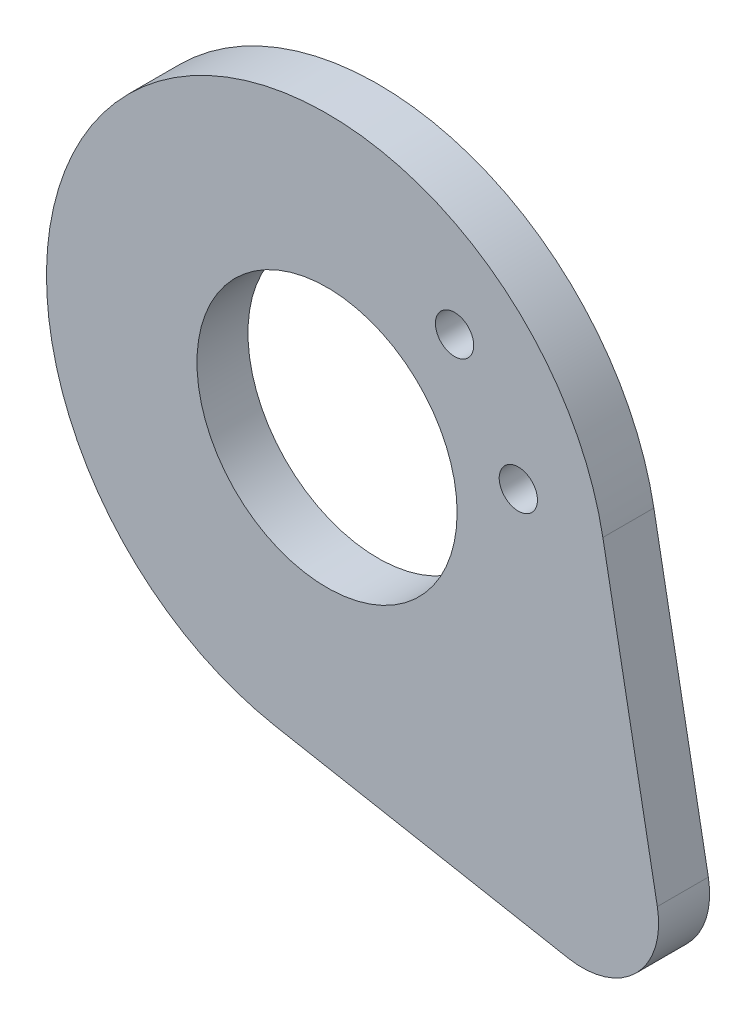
SolidWorks part; units mm, degrees
ref_plane "Alzado" through (0, 0, 0) normal (0, 0, 1) x (1, 0, 0)
ref_plane "Planta" through (0, 0, 0) normal (0, 1, 0) x (1, 0, 0)
ref_plane "Vista lateral" through (0, 0, 0) normal (1, 0, 0) x (0, 0, -1)
ref_plane "Plano1" through (0, 0, 52.4) normal (0, 0, 1) x (1, 0, 0)
sketch "Sk_Placa_tope" plane through (0, 0, 52.4) normal (0, 0, 1) x (1, 0, 0)
  line L0 (-8.014, -36.814) -> (3.4507, -38.9493)
  line L1 (6.9493, -35.4507) -> (4.814, -23.986)
  arc A0 (3.4507, -38.9493) -> (6.9493, -35.4507) centre (4, -36) ccw
  arc A1 (4.814, -23.986) -> (-8.014, -36.814) centre (-6, -26) ccw
  circle A2 centre (-6, -26) radius 5.1
  circle A3 centre (-1, -20) radius 0.75
  circle A4 centre (1.5, -24) radius 0.75
extrude "Placa_tope" add sketch "Sk_Placa_tope" along normal blind 2
